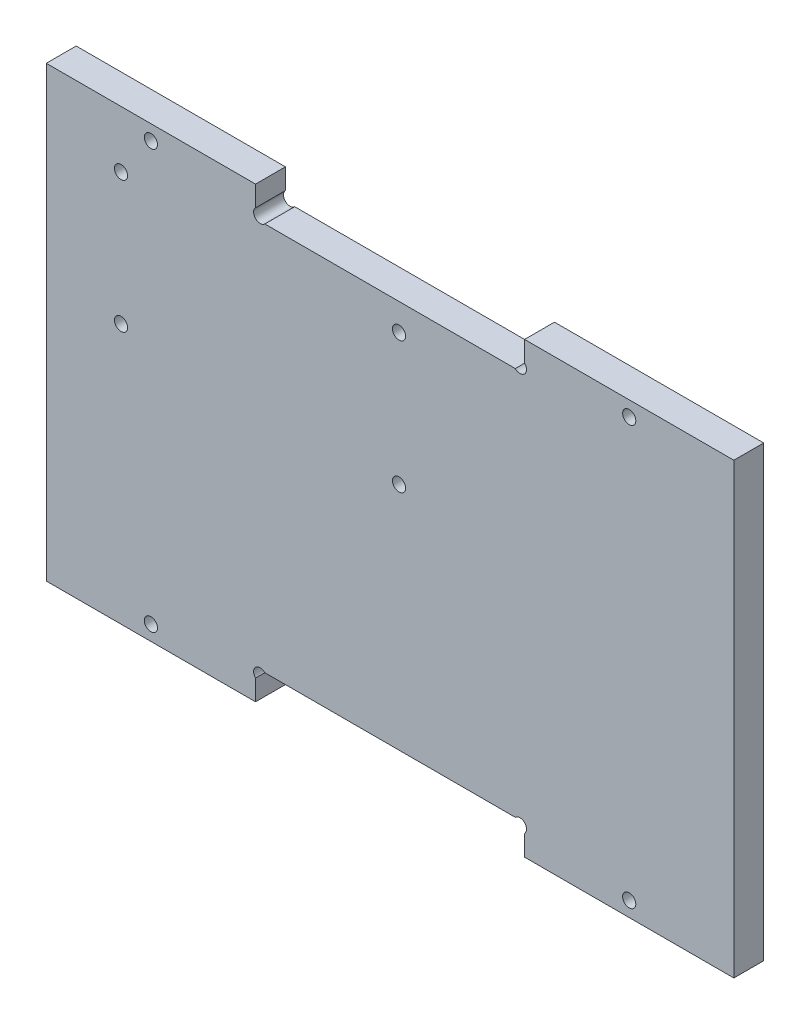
SolidWorks part; units mm, degrees
ref_plane "Plan de face" through (0, 0, 0) normal (0, 0, 1) x (1, 0, 0)
ref_plane "Plan de dessus" through (0, 0, 0) normal (0, 1, 0) x (1, 0, 0)
ref_plane "Plan de droite" through (0, 0, 0) normal (1, 0, 0) x (0, 0, -1)
sketch "Esquisse1" plane through (0, 0, 0) normal (0, 0, 1) x (1, 0, 0)
  line L1 (0, 0) -> (115, 0)
  line L2 (0, 0) -> (0, 75)
  line L3 (0, 75) -> (115, 75)
  line L4 (115, 0) -> (115, 75)
  dimension "D1" = 115
  dimension "D2" = 75
extrude "Boss.-Extru.1" add sketch "Esquisse1" along normal blind 5
sketch "Esquisse2" plane through (0, 0, 5) normal (0, 0, 1) x (1, 0, 0)
  line L0 (115, 75) -> (0, 75) construction
  line L1 (0, 75) -> (0, 0) construction
  circle A0 centre (4.75, 65.25) radius 1.1
  circle A1 centre (4.75, 10.25) radius 1.1
  circle A2 centre (98.05, 65.25) radius 1.1
  dimension "D2" = 55
  dimension "D5" = 2.2
  dimension "D6" = 2.2
  dimension "D7" = 2.2
  dimension "D1" = 93.3
  dimension "D3" = 9.75
  dimension "D4" = 4.75
extrude "Enlèv. mat.-Extru.1" [suppressed] cut sketch "Esquisse2" against normal up to next
sketch "Esquisse3" plane through (0, 0, 5) normal (0, 0, 1) x (1, 0, 0)
  line L0 (115, 75) -> (0, 75) construction
  line L1 (0, 75) -> (0, 0) construction
  circle A0 centre (12.5, 65.5) radius 1.1
  circle A1 centre (59, 65.5) radius 1.1
  circle A2 centre (59, 43.5) radius 1.1
  circle A3 centre (12.5, 43.5) radius 1.1
  dimension "D1" = 2.2
  dimension "D2" = 2.2
  dimension "D3" = 2.2
  dimension "D4" = 2.2
  dimension "D5" = 46.5
  dimension "D6" = 22
  dimension "D7" = 9.5
  dimension "D8" = 12.5
extrude "Enlèv. mat.-Extru.2" cut sketch "Esquisse3" against normal up to next
sketch "Esquisse5" [suppressed] plane through (0, 0, 0) normal (0, 0, -1) x (-1, 0, 0)
  circle A0 centre (-98.05, 65.25) radius 2
  circle A1 centre (-4.75, 10.25) radius 2
  circle A2 centre (-4.75, 65.25) radius 2
  dimension "D1" = 4
  dimension "D2" = 4
  dimension "D3" = 4
extrude "Enlèv. mat.-Extru.3" [suppressed] cut sketch "Esquisse5" against normal blind 1.5
sketch "Esquisse6" plane through (0, 0, 0) normal (0, 0, -1) x (-1, 0, 0)
  line L0 (-115, 75) -> (0, 75) construction
  line L1 (-80, 75) -> (-35, 75)
  line L2 (-80, 75) -> (-80, 70)
  line L3 (-80, 70) -> (-35, 70)
  line L4 (-35, 75) -> (-35, 70)
  line L5 (-115, 0) -> (-115, 75) construction
  line L6 (0, 0) -> (-115, 0) construction
  line L7 (-80, 0) -> (-35, 0)
  line L8 (-80, 0) -> (-80, 5)
  line L9 (-80, 5) -> (-35, 5)
  line L10 (-35, 0) -> (-35, 5)
  dimension "D1" = 5
  dimension "D2" = 45
  dimension "D3" = 35
  dimension "D4" = 45
  dimension "D5" = 5
  dimension "D6" = 35
extrude "Enlèv. mat.-Extru.4" cut sketch "Esquisse6" against normal up to next
sketch "Esquisse7" plane through (0, 0, 0) normal (0, 0, -1) x (-1, 0, 0)
  line L0 (-80, 70) -> (-64.4144, 85.5856) construction
  line L1 (-35, 70) -> (-47.5155, 82.5155) construction
  line L2 (-35, 5) -> (-48.0935, -8.0935) construction
  line L3 (-80, 5) -> (-65.1639, -9.8361) construction
  line L4 (-80, 70) -> (-35, 70) construction
  line L5 (-35, 5) -> (-80, 5) construction
  circle A0 centre (-35.7778, 70.7778) radius 1.1
  circle A1 centre (-79.2222, 70.7778) radius 1.1
  circle A2 centre (-79.2222, 4.2222) radius 1.1
  circle A3 centre (-35.7778, 4.2222) radius 1.1
  dimension "D5" = 2.2
  dimension "D6" = 2.2
  dimension "D7" = 2.2
  dimension "D8" = 2.2
  dimension "D1" = 45
  dimension "D2" = 45
  dimension "D3" = 45
  dimension "D4" = 45
extrude "Enlèv. mat.-Extru.5" cut sketch "Esquisse7" against normal up to next
ref_plane "Plan1" through (0, 37.5, 0) normal (0, 1, 0) x (-1, 0, 0)
ref_plane "Plan2" through (57.5, 0, 0) normal (1, 0, 0) x (0, 0, -1)
sketch "Esquisse8" plane through (0, 0, 0) normal (0, 0, -1) x (-1, 0, 0)
  line L0 (-35, 75) -> (0, 75) construction
  line L1 (-17.5, 75) -> (-17.5, 57.6403) construction
  circle A0 centre (-17.5, 72.5) radius 1.1
  dimension "D1" = 2.2
  dimension "D2" = 2.5
extrude "Enlèv. mat.-Extru.6" cut sketch "Esquisse8" against normal up to next
mirror "Symétrie1" about plane through (57.5, 0, 0) normal (1, 0, 0) of "Enlèv. mat.-Extru.6"
mirror "Symétrie2" about plane through (0, 37.5, 0) normal (0, 1, 0) of "Symétrie1", "Enlèv. mat.-Extru.6"
